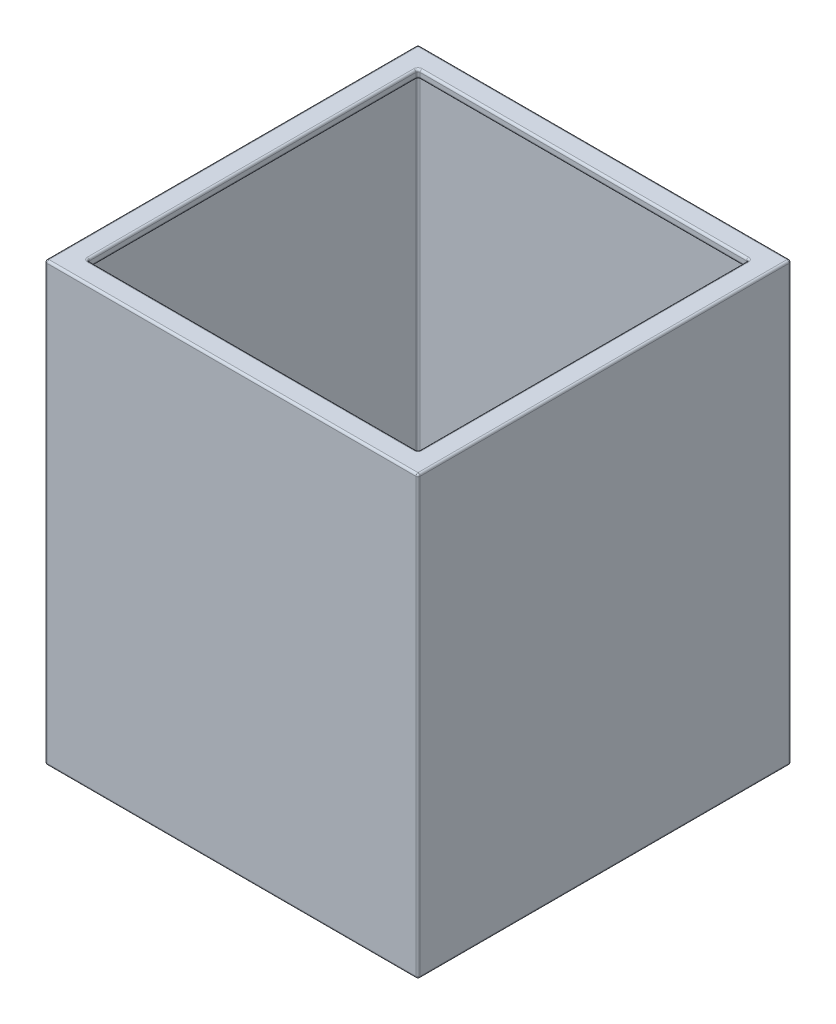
SolidWorks part; units mm, degrees
ref_plane "Front Plane" through (0, 0, 0) normal (0, 0, 1) x (1, 0, 0)
ref_plane "Top Plane" through (0, 0, 0) normal (0, 1, 0) x (1, 0, 0)
ref_plane "Right Plane" through (0, 0, 0) normal (1, 0, 0) x (0, 0, -1)
sketch "Sketch1" plane through (0, 0, 0) normal (0, 1, 0) x (1, 0, 0)
  line L1 (0, 0) -> (111.125, 0)
  line L2 (0, 0) -> (0, 111.125)
  line L3 (0, 111.125) -> (111.125, 111.125)
  line L4 (111.125, 0) -> (111.125, 111.125)
  dimension "D1" = 111.125
extrude "Boss-Extrude1" add sketch "Sketch1" along normal blind 130.175
sketch "Sketch2" plane through (0, 130.175, 0) normal (0, 1, 0) x (1, 0, 0)
  line L0 (0, 111.125) -> (0, 0) construction
  line L1 (111.125, 111.125) -> (0, 111.125) construction
  line L14 (6.35, 104.775) -> (6.35, 6.35)
  line L15 (6.35, 6.35) -> (104.775, 6.35)
  line L16 (104.775, 6.35) -> (104.775, 104.775)
  line L17 (104.775, 104.775) -> (6.35, 104.775)
  line L18 (6.35, 104.775) -> (6.35, 6.35)
  line L19 (6.35, 6.35) -> (104.775, 6.35)
  line L20 (104.775, 6.35) -> (104.775, 104.775)
  line L21 (104.775, 104.775) -> (6.35, 104.775)
  ellipse E0 centre (55.5625, 55.5625) end of major axis (100.0125, 55.5625) minor radius 31.75 construction
  point P8 (0, 55.5625)
  point P11 (55.5625, 111.125)
  dimension "D1" = 88.9
  dimension "D2" = 63.5
  dimension "D3" = 6.35
extrude "Cut-Extrude1" cut sketch "Sketch2" against normal offset from surface (127.635 mm away) 2.54
sketch "Sketch3" plane through (0, 2.54, 0) normal (0, 1, 0) x (1, 0, 0)
  line L8 (2.54, 108.585) -> (2.54, 2.54)
  line L9 (2.54, 2.54) -> (108.585, 2.54)
  line L10 (108.585, 2.54) -> (108.585, 108.585)
  line L11 (108.585, 108.585) -> (2.54, 108.585)
  line L12 (2.54, 108.585) -> (2.54, 2.54)
  line L13 (2.54, 2.54) -> (108.585, 2.54)
  line L14 (108.585, 2.54) -> (108.585, 108.585)
  line L15 (108.585, 108.585) -> (2.54, 108.585)
  dimension "D1" = 2.54
extrude "Cut-Extrude2" cut sketch "Sketch3" along normal offset from surface (125.095 mm away) 2.54
fillet "Fillet1" radius 0.635 36 edges at (2.54, 65.0875, -2.54) (108.585, 65.0875, -2.54) (2.54, 65.0875, -108.585) (108.585, 65.0875, -108.585) (111.125, 65.0875, -111.125) (111.125, 65.0875, 0) (0, 65.0875, -111.125) (0, 65.0875, 0) (55.5625, 0, 0) (111.125, 0, -55.5625) (55.5625, 0, -111.125) (0, 0, -55.5625) (108.585, 2.54, -55.5625) (108.585, 127.635, -55.5625) (55.5625, 2.54, -2.54) (55.5625, 127.635, -2.54) (2.54, 2.54, -55.5625) (2.54, 127.635, -55.5625) (55.5625, 2.54, -108.585) (55.5625, 127.635, -108.585) (55.5625, 130.175, -111.125) (111.125, 130.175, -55.5625) (55.5625, 130.175, 0) (0, 130.175, -55.5625) (104.775, 130.175, -55.5625) (55.5625, 130.175, -104.775) (6.35, 130.175, -55.5625) (55.5625, 130.175, -6.35) (104.775, 127.635, -55.5625) (55.5625, 127.635, -6.35) (6.35, 127.635, -55.5625) (6.35, 128.905, -6.35) (104.775, 128.905, -6.35) (104.775, 128.905, -104.775) (6.35, 128.905, -104.775) (55.5625, 127.635, -104.775)
